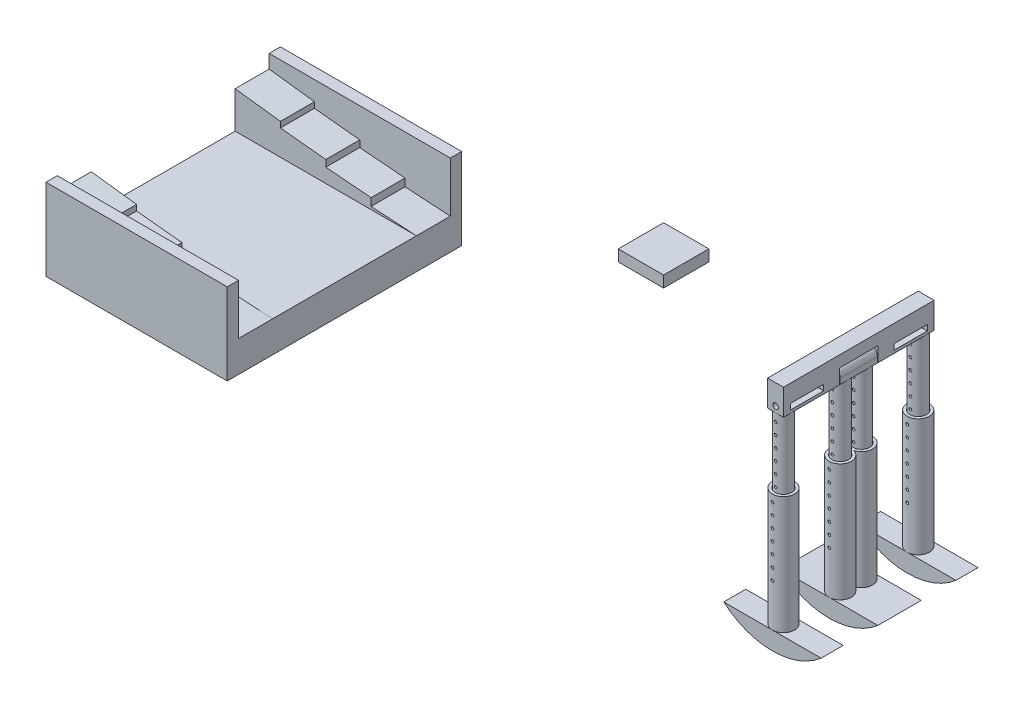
SolidWorks part; units mm, degrees
ref_plane "Front Plane" through (0, 0, 0) normal (0, 0, 1) x (1, 0, 0)
ref_plane "Top Plane" through (0, 0, 0) normal (0, 1, 0) x (1, 0, 0)
ref_plane "Right Plane" through (0, 0, 0) normal (1, 0, 0) x (0, 0, -1)
sketch "Sketch1" plane through (0, 0, 0) normal (0, 0, 1) x (1, 0, 0)
  line L0 (-3.5, -2.5) -> (-3.5, 9)
  line L1 (-3.5, 9) -> (3.5, 9)
  line L2 (3.5, 9) -> (3.5, -2.5)
  line L3 (3.5, -2.5) -> (-3.5, -2.5)
  line L4 (-3.5, -2.5) -> (-3.5, -45.5)
  line L5 (-3.5, -45.5) -> (3.5, -45.5)
  line L6 (3.5, -45.5) -> (3.5, -2.5)
  line L7 (0, -6) -> (0, -11) construction
  line L8 (-4.875, -32.9) -> (-4.875, -84.9)
  line L9 (-4.875, -84.9) -> (-21.5, -84.9)
  line L10 (21.5, -84.9) -> (4.875, -84.9)
  line L11 (4.875, -84.9) -> (4.875, -32.9)
  line L12 (4.875, -32.9) -> (-4.875, -32.9)
  line L13 (0, -32.9) -> (0, -92.9) construction
  line L14 (0, -36) -> (0, -41) construction
  circle A0 centre (0, 0) radius 1.25
  circle A1 centre (0, -6) radius 0.6
  circle A2 centre (0, -11) radius 0.6
  circle A3 centre (0, -16) radius 0.6
  circle A4 centre (0, -21) radius 0.6
  circle A5 centre (0, -26) radius 0.6
  circle A6 centre (0, -31) radius 0.6
  circle A7 centre (0, -36) radius 0.6
  arc A8 (-21.5, -84.9) -> (21.5, -84.9) centre (0, -60.0094) ccw
  circle A9 centre (0, -36) radius 0.6
  circle A10 centre (0, -41) radius 0.6
  circle A11 centre (0, -46) radius 0.6
  circle A12 centre (0, -51) radius 0.6
  circle A13 centre (0, -56) radius 0.6
  circle A14 centre (0, -61) radius 0.6
  circle A15 centre (0, -66) radius 0.6
  point P4 (0, 9)
  point P35 (0, -92.9)
  dimension "D4" = 2.5
  dimension "D6" = 1.2
  dimension "D13" = 1.2
  dimension "D1" = 7
  dimension "D2" = 11.5
  dimension "D3" = 9
  dimension "D5" = 54.5
  dimension "D7" = 15
  dimension "D9" = 5
  dimension "D10" = 8
  dimension "D11" = 43
  dimension "D12" = 9.75
  dimension "D14" = 3.1
  dimension "D16" = 52
  dimension "D17" = 5
  dimension "D8" = 7
  dimension "D15" = 7
sketch "Sketch2" plane through (0, 0, 0) normal (0, 0, 1) x (1, 0, 0)
  line L0 (-3.5, -2.5) -> (-3.5, 9)
  line L1 (-3.5, 9) -> (3.5, 9)
  line L2 (3.5, 9) -> (3.5, -2.5)
  line L3 (3.5, -2.5) -> (-3.5, -2.5)
extrude "Boss-Extrude1" add sketch "Sketch2" along normal blind 33.25
sketch "Sketch3" plane through (0, 0, 0) normal (0, 0, 1) x (1, 0, 0)
  line L0 (-3.5, -2.5) -> (-3.5, 9) construction
  line L1 (3.5, -2.5) -> (-3.5, -2.5)
  line L2 (3.5, -2.5) -> (3.5, 4)
  line L3 (3.5, 4) -> (-3.5, 4)
  line L4 (-3.5, -2.5) -> (-3.5, 4)
  dimension "D1" = 5
extrude "Cut-Extrude2" cut sketch "Sketch3" along normal blind 8.5
sketch "Sketch4" plane through (0, 0, 33.25) normal (0, 0, 1) x (1, 0, 0)
  circle A0 centre (0, 0) radius 1.1
  dimension "D1" = 2.2
extrude "Cut-Extrude3" cut sketch "Sketch4" against normal offset from surface (22.25 mm away) 2.5
sketch "Sketch5" plane through (0, 0, 8.5) normal (0, 0, -1) x (-1, 0, 0)
  circle A0 centre (0, 0) radius 1
  dimension "D1" = 2
extrude "Cut-Extrude4" cut sketch "Sketch5" against normal up to next
sketch "Sketch6" plane through (3.5, 0, 0) normal (1, 0, 0) x (0, 0, -1)
  line L0 (-33.25, 9) -> (0, 9) construction
  line L1 (-30.25, 1.25) -> (-15.5, 1.25)
  line L2 (-30.25, 1.25) -> (-30.25, -1.25)
  line L3 (-30.25, -1.25) -> (-15.5, -1.25)
  line L4 (-15.5, 1.25) -> (-15.5, -1.25)
  line L5 (-33.25, -2.5) -> (-33.25, 9) construction
  line L6 (-8.5, -2.5) -> (-8.5, 4) construction
  dimension "D1" = 7.75
  dimension "D2" = 10.25
  dimension "D3" = 3
  dimension "D4" = 7
extrude "Cut-Extrude5" cut sketch "Sketch6" against normal blind 3
sketch "Sketch7" plane through (0, -2.5, 0) normal (0, -1, 0) x (1, 0, 0)
  line L0 (-3.5, 33.25) -> (3.5, 33.25) construction
  line L1 (-3.5, 33.25) -> (-3.5, 8.5) construction
  circle A0 centre (0, 29.75) radius 3.5
extrude "Boss-Extrude2" add sketch "Sketch7" along normal up to vertex
ref_plane "Plane1" through (0, 0, 29.75) normal (0, 0, 1) x (1, 0, 0)
sketch "Sketch8" plane through (0, 0, 29.75) normal (0, 0, 1) x (1, 0, 0)
  line L0 (4.875, -84.9) -> (-4.875, -84.9)
  line L1 (21.5, -84.9) -> (4.875, -84.9) construction
  line L2 (-4.875, -84.9) -> (-21.5, -84.9) construction
  line L3 (21.5, -84.9) -> (4.875, -84.9)
  line L4 (-4.875, -84.9) -> (-21.5, -84.9)
  arc A0 (-21.5, -84.9) -> (21.5, -84.9) centre (0, -60.0094) ccw construction
  arc A1 (-21.5, -84.9) -> (21.5, -84.9) centre (0, -60.0094) ccw
extrude "Boss-Extrude3" add sketch "Sketch8" along normal mid plane 9.75 separate body
sketch "Sketch9" plane through (0, -84.9, 0) normal (0, 1, 0) x (1, 0, 0)
  line L0 (21.5, -24.875) -> (-21.5, -24.875) construction
  line L1 (21.5, -34.625) -> (-21.5, -34.625) construction
  circle A0 centre (0, -29.75) radius 4.875
  point P7 (0, -34.625)
extrude "Boss-Extrude4" add sketch "Sketch9" along normal up to vertex
sketch "Sketch10" plane through (0, -32.9, 0) normal (0, 1, 0) x (1, 0, 0)
  circle A0 centre (0, -29.75) radius 3.65
  dimension "D1" = 7.3
extrude "Cut-Extrude6" cut sketch "Sketch10" against normal blind 40
ref_plane "Plane2" through (0, -45.5, 0) normal (0, -1, 0) x (1, 0, 0)
sketch "Sketch11" plane through (0, 0, 0) normal (1, 0, 0) x (0, 0, -1)
  line L0 (-8.2, 3.5) -> (-8.2, -45.5)
  line L1 (-8.2, -45.5) -> (-1.2, -45.5)
  line L2 (-1.2, -45.5) -> (-1.2, -2.5)
  line L3 (-1.2, -2.5) -> (0, -2.5)
  line L4 (0, -2.5) -> (0, 9) construction
  line L5 (0, -2.5) -> (0, 3.5)
  line L6 (0, 3.5) -> (-8.2, 3.5)
  line L7 (-3.85, -45.5) -> (3.85, -45.5) construction
  line L8 (-29.75, -2.5) -> (-26.25, -2.5) construction
  dimension "D1" = 49
  dimension "D2" = 8.2
  dimension "D3" = 7
sketch "Sketch12" plane through (0, 0, 0) normal (0, 0, 1) x (1, 0, 0)
  line L0 (-3.5, -2.5) -> (-3.5, 9) construction
  line L1 (3.5, 9) -> (3.5, -2.5) construction
  line L2 (-3.5, 0) -> (-3.5, -2.5)
  line L3 (-3.5, -2.5) -> (3.5, -2.5)
  line L4 (3.5, -2.5) -> (3.5, 0)
  arc A0 (-3.5, 0) -> (3.5, 0) centre (0, 0) cw
  circle A1 centre (0, 0) radius 1.3
  dimension "D1" = 2.6
extrude "Boss-Extrude5" add sketch "Sketch12" along normal up to vertex separate body
sketch "Sketch13" plane through (0, -2.5, 0) normal (0, -1, 0) x (1, 0, 0)
  line L0 (3.5, 8.2) -> (3.5, 0) construction
  line L1 (-3.5, 8.2) -> (3.5, 8.2) construction
  circle A0 centre (0, 4.7) radius 3.5
extrude "Boss-Extrude6" add sketch "Sketch13" along normal up to surface (43 mm away)
move or copy body "Body-Move/Copy2" bodies to move or copy 110 copy yes number of copies 1 translate (0, 0, -13)
move or copy body "Body-Move/Copy3" bodies to move or copy 114 placed by mates yes
sketch "Sketch14" plane through (0, 0, 0) normal (0, 0, 1) x (1, 0, 0)
  circle A0 centre (0, -6) radius 0.6
  circle A1 centre (0, -6) radius 0.6 construction
extrude "Cut-Extrude7" cut sketch "Sketch14" along normal through all
pattern_linear "LPattern1" count 7 spacing 5 along (0, -1, 0) of "Cut-Extrude7"
sketch "Sketch15" plane through (0, 0, 0) normal (0, 0, 1) x (1, 0, 0)
  circle A0 centre (0, -36) radius 0.6
  circle A1 centre (0, -36) radius 0.6 construction
extrude "Cut-Extrude8" cut sketch "Sketch15" along normal through all and the other way through all
pattern_linear "LPattern2" count 7 spacing 5 along (0, -1, 0) of "Cut-Extrude8"
mirror "Mirror1" about plane through (0, 0, 0) normal (0, 0, 1)
mirror "Mirror2" about plane through (0, 0, 0) normal (0, 0, -1)
mirror "Mirror3" about plane through (0, 0, 0) normal (0, 0, 1)
move or copy body "Body-Move/Copy4" bodies to move or copy 123 copy yes number of copies 1 translate (0, 0, -65.1603)
move or copy body "Body-Move/Copy5" bodies to move or copy 128 placed by mates yes
sketch "Sketch16" plane through (0, -32.9, 0) normal (0, 1, 0) x (1, 0, 0)
  circle A0 centre (0, 4.7) radius 3.7
  circle A3 centre (0, -4.7) radius 3.7
  circle A4 centre (0, -4.7) radius 3.65 construction
  circle A5 centre (0, 4.7) radius 3.65 construction
  point P5 (0, 0)
  dimension "D1" = 0.05
  dimension "D2" = 0.05
sketch "Sketch17" plane through (0, 0, -33.25) normal (0, 0, -1) x (-1, 0, 0)
  circle A0 centre (0, 0) radius 1.225
  circle A1 centre (0, 0) radius 1.1 construction
  dimension "D1" = 0.125
extrude "Cut-Extrude9" cut sketch "Sketch17" against normal through all
ref_plane "Plane3" through (0, -92.9, 0) normal (0, -1, 0) x (-1, 0, 0)
sketch "Sketch18" plane through (0, -92.9, 0) normal (0, -1, 0) x (-1, 0, 0)
  line L1 (122, -46.5) -> (-122, -46.5)
  line L2 (122, -46.5) -> (122, 46.5)
  line L3 (122, 46.5) -> (-122, 46.5)
  line L4 (-122, -46.5) -> (-122, 46.5)
  line L5 (122, -46.5) -> (-122, 46.5) construction
  line L6 (122, 46.5) -> (-122, -46.5) construction
  point P0 (0, 0)
  dimension "D1" = 93
  dimension "D2" = 244
sketch "Sketch19" plane through (0, 0, 0) normal (0, 0, 1) x (1, 0, 0)
  line L4 (-263.5385, -69.96) -> (-283.5385, -67.9)
  line L5 (-283.5385, -67.9) -> (-283.5385, -65.3778)
  line L6 (-283.5385, -65.3778) -> (-303.5385, -62.9)
  line L7 (-303.5385, -62.9) -> (-303.5385, -92.9)
  line L8 (-303.5385, -92.9) -> (-223.5385, -92.9)
  line L9 (-223.5385, -92.9) -> (-223.5385, -79.1318)
  line L10 (-223.5385, -79.1318) -> (-243.5385, -77.9)
  line L11 (-243.5385, -77.9) -> (-243.5385, -74.5449)
  line L12 (-243.5385, -74.5449) -> (-263.5385, -72.9)
  line L13 (-263.5385, -72.9) -> (-263.5385, -69.96)
  line L14 (-122, -92.9) -> (122, -92.9) construction
  line L15 (-243.5385, -77.9) -> (0, -92.9) construction
  line L16 (-263.5385, -72.9) -> (-20.3596, -92.9) construction
  line L17 (-283.5385, -67.9) -> (-40.8226, -92.9) construction
  line L18 (-303.5385, -62.9) -> (-61.3898, -92.9) construction
  point P5 (0, 0)
  point P13 (-293.4069, -64.4398)
  point P17 (0, 0)
  point P19 (0, 0)
  dimension "D1" = 244
  dimension "D2" = 15
  dimension "D3" = 20
  dimension "D4" = 20
  dimension "D5" = 25
  dimension "D6" = 30
  dimension "D7" = 20
  dimension "D8" = 20
  dimension "D9" = 20
  dimension "D10" = 244
  dimension "D11" = 244
  dimension "D12" = 244
extrude "Boss-Extrude7" add sketch "Sketch19" along normal mid plane 93.5 separate body
sketch "Sketch20" plane through (0, 0, 46.75) normal (0, 0, 1) x (1, 0, 0)
  line L1 (-223.5385, -92.9) -> (-303.5385, -92.9)
  line L2 (-223.5385, -92.9) -> (-223.5385, -56.9)
  line L3 (-223.5385, -56.9) -> (-303.5385, -56.9)
  line L4 (-303.5385, -92.9) -> (-303.5385, -56.9)
  dimension "D1" = 6
extrude "Boss-Extrude8" add sketch "Sketch20" along normal blind 5
mirror "Mirror4" about plane through (0, 0, 0) normal (0, 0, 1) of "Boss-Extrude8"
ref_plane "Plane4" through (0, -79.1318, 0) normal (0, -1, 0) x (-1, 0, 0)
sketch "Sketch22" plane through (0, -79.1318, 0) normal (0, -1, 0) x (-1, 0, 0)
  line L0 (223.5385, -46.75) -> (223.5385, 46.75) construction
  line L1 (223.5385, -31.75) -> (303.5385, -31.75)
  line L2 (223.5385, -31.75) -> (223.5385, 31.75)
  line L3 (223.5385, 31.75) -> (303.5385, 31.75)
  line L4 (303.5385, -31.75) -> (303.5385, 31.75)
  line L5 (303.5385, -46.75) -> (303.5385, 46.75) construction
  point P6 (0, 0)
  point P10 (0, 0)
  point P12 (0, 0)
  dimension "D1" = 15
  dimension "D2" = 15
extrude "Cut-Extrude10" cut sketch "Sketch22" against normal through all
sketch "Sketch23" plane through (0, 0, 0) normal (0, 1, 0) x (1, 0, 0)
  line L1 (-89.8548, 7.1814) -> (-69.8548, 7.1814)
  line L2 (-89.8548, 7.1814) -> (-89.8548, -12.8186)
  line L3 (-89.8548, -12.8186) -> (-69.8548, -12.8186)
  line L4 (-69.8548, 7.1814) -> (-69.8548, -12.8186)
  line L5 (-89.8548, 7.1814) -> (-69.8548, -12.8186) construction
  line L6 (-89.8548, -12.8186) -> (-69.8548, 7.1814) construction
  point P0 (-79.8548, -2.8186)
  dimension "D1" = 20
extrude "Boss-Extrude9" add sketch "Sketch23" along normal blind 5 separate body
sketch "Sketch24" plane through (0, 0, 0) normal (0, -1, 0) x (-1, 0, 0)
  line L0 (69.8548, 7.1814) -> (89.8548, 7.1814) construction
  line L1 (82.2798, -5.2436) -> (77.4298, -5.2436)
  line L2 (82.2798, -5.2436) -> (82.2798, -0.3936)
  line L3 (82.2798, -0.3936) -> (77.4298, -0.3936)
  line L4 (77.4298, -5.2436) -> (77.4298, -0.3936)
  line L5 (82.2798, -5.2436) -> (77.4298, -0.3936) construction
  line L6 (82.2798, -0.3936) -> (77.4298, -5.2436) construction
  line L7 (89.8548, 7.1814) -> (89.8548, -12.8186) construction
  line L8 (69.8548, -2.8186) -> (89.8548, -2.8186) construction
  line L9 (69.8548, -12.8186) -> (69.8548, 7.1814) construction
  point P0 (79.8548, -2.8186)
  point P8 (79.8548, 7.1814)
  point P16 (0, 0)
  dimension "D1" = 4.85
  dimension "D2" = 4.85
extrude "Boss-Extrude10" add sketch "Sketch24" along normal blind 4
